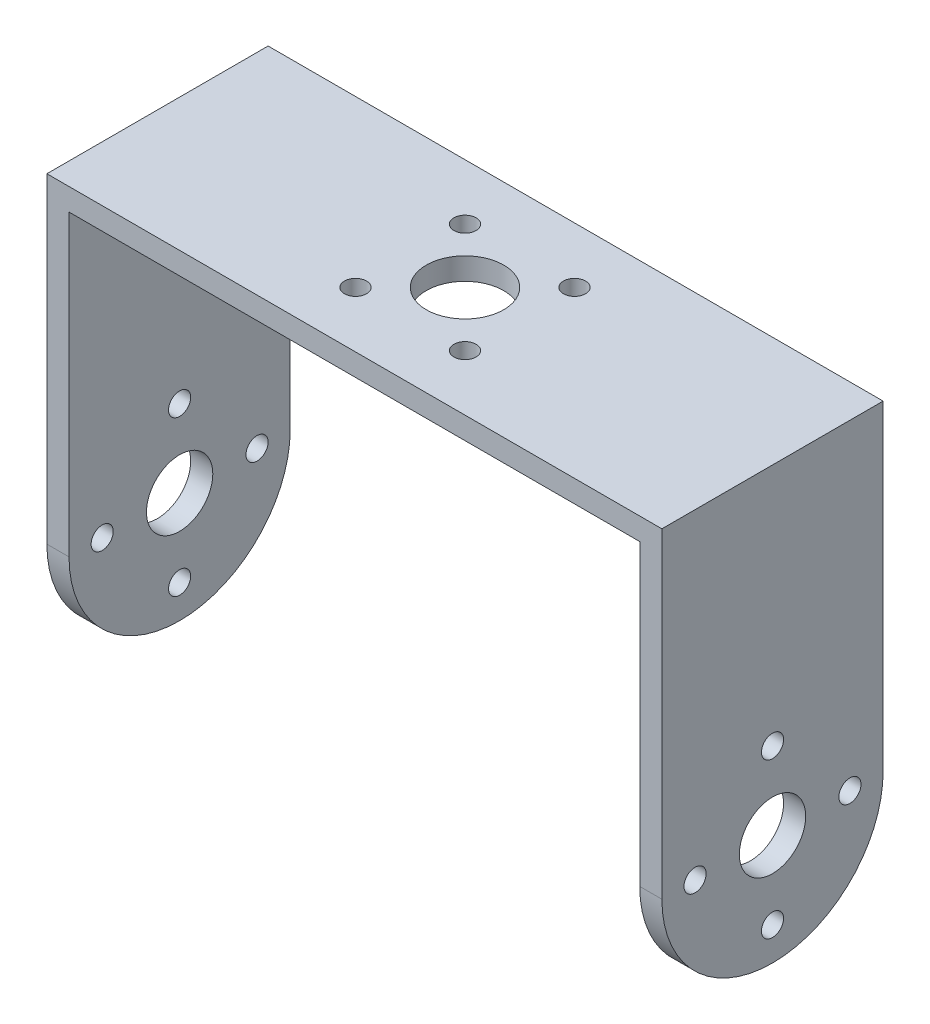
SolidWorks part; units mm, degrees
ref_plane "Front Plane" through (0, 0, 0) normal (0, 0, 1) x (1, 0, 0)
ref_plane "Top Plane" through (0, 0, 0) normal (0, 1, 0) x (1, 0, 0)
ref_plane "Right Plane" through (0, 0, 0) normal (1, 0, 0) x (0, 0, -1)
sketch "Sketch1" plane through (0, 0, 0) normal (0, 0, 1) x (1, 0, 0)
  line L0 (-25.8, -18.5) -> (-27.8, -18.5)
  line L1 (-25.8, 18.5) -> (25.8, 18.5)
  line L2 (-25.8, 18.5) -> (-25.8, -18.5)
  line L3 (-27.8, -18.5) -> (-27.8, 20.5)
  line L4 (25.8, 18.5) -> (25.8, -18.5)
  line L5 (-25.8, 18.5) -> (25.8, -18.5) construction
  line L6 (-25.8, -18.5) -> (25.8, 18.5) construction
  line L7 (-27.8, 20.5) -> (27.8, 20.5)
  line L8 (27.8, 20.5) -> (27.8, -18.5)
  line L9 (27.8, -18.5) -> (25.8, -18.5)
  point P0 (0, 0)
  dimension "D1" = 51.6
  dimension "D2" = 37
  dimension "D3" = 2
  dimension "D4" = 2
extrude "Boss-Extrude1" add sketch "Sketch1" along normal blind 20
fillet "Fillet1" radius 10 4 edges at (26.8, -18.5, 20) (26.8, -18.5, 0) (-26.8, -18.5, 20) (-26.8, -18.5, 0)
sketch "Sketch2" plane through (27.8, 0, 0) normal (1, 0, 0) x (0, 0, -1)
  line L0 (-10, -18.5) -> (-10, 20.5) construction
  line L1 (-20, 20.5) -> (0, 20.5) construction
  circle A0 centre (-10, -8.5) radius 3
  circle A1 centre (-10, -1.5) radius 1
  circle A2 centre (-3, -8.5) radius 1
  circle A3 centre (-10, -15.5) radius 1
  circle A4 centre (-17, -8.5) radius 1
  point P18 (-10, -8.5)
  dimension "D1" = 6
  dimension "D2" = 7
  dimension "D3" = 2
  dimension "D4" = 4
  dimension "D5" = 10
extrude "Cut-Extrude2" cut sketch "Sketch2" against normal blind 3.5 contours A1 L0 | L0 A1 | A4 | L0 A3 | A3 L0 | L0 A0 | A0 L0 | A2
pattern_linear "LPattern1" count 2 spacing 53.6 along (-1, 0, 0) of "Cut-Extrude2"
sketch "Sketch3" plane through (0, 20.5, 0) normal (0, 1, 0) x (1, 0, 0)
  line L0 (0, 0) -> (0, -20) construction
  line L1 (27.8, -20) -> (-27.8, -20) construction
  line L2 (4.9497, -5.0503) -> (0, -10) construction
  line L4 (-4.9497, -14.9497) -> (4.9497, -14.9497)
  line L5 (-4.9497, -14.9497) -> (-4.9497, -5.0503)
  line L6 (-4.9497, -5.0503) -> (4.9497, -5.0503)
  line L7 (4.9497, -14.9497) -> (4.9497, -5.0503)
  line L8 (-4.9497, -14.9497) -> (4.9497, -5.0503) construction
  line L9 (-4.9497, -5.0503) -> (4.9497, -14.9497) construction
  circle A0 centre (0, -10) radius 3.5
  circle A1 centre (4.9497, -5.0503) radius 1
  circle A2 centre (4.9497, -14.9497) radius 1
  circle A3 centre (-4.9497, -14.9497) radius 1
  circle A4 centre (-4.9497, -5.0503) radius 1
  point P21 (0, -10)
  dimension "D1" = 7
  dimension "D4" = 2
  dimension "D2" = 7
  dimension "D3" = 4
extrude "Cut-Extrude3" cut sketch "Sketch3" against normal up to next contours A0 | L7 A1 L6 | L6 A1 L7 | L5 A4 L6 | L6 A4 L5 | L5 A3 L4 | L4 A3 L5 | L4 A2 L7 | L7 A2 L4
